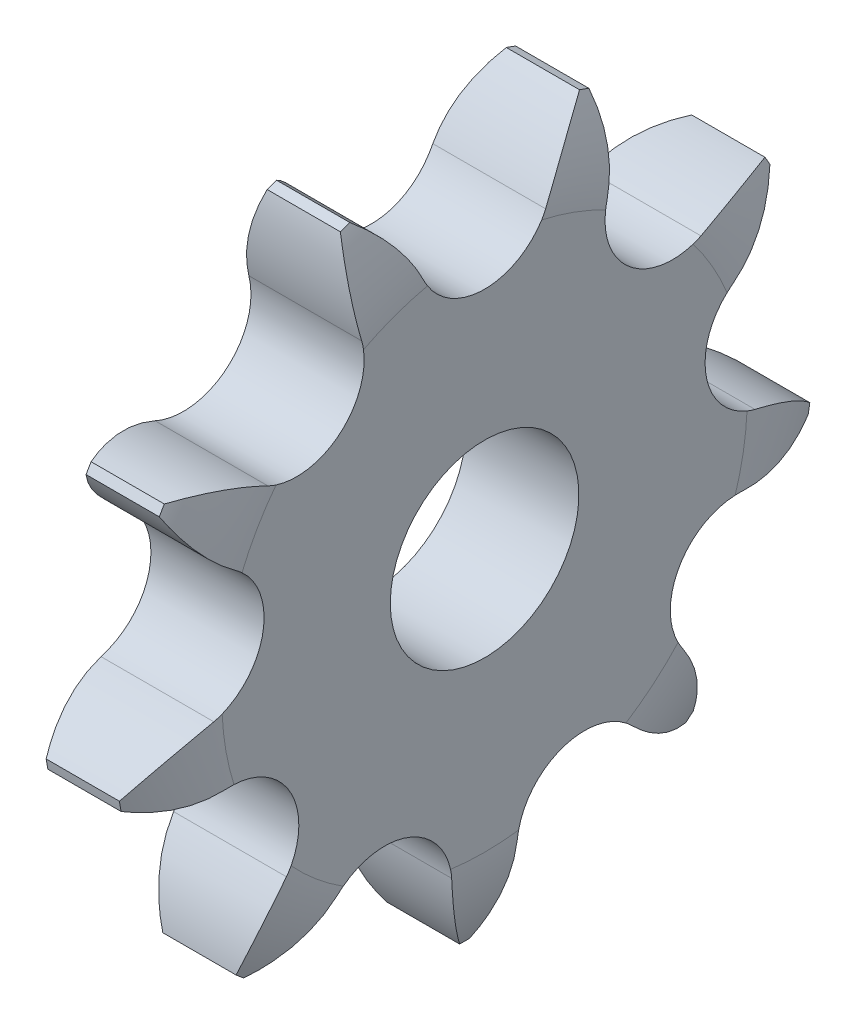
SolidWorks part; units mm, degrees
ref_plane "Plane1" through (0, 0, 0) normal (0, 0, 1) x (1, 0, 0)
ref_plane "Plane2" through (0, 0, 0) normal (0, 1, 0) x (1, 0, 0)
ref_plane "Plane3" through (0, 0, 0) normal (1, 0, 0) x (0, 0, -1)
sketch "Clipboard" plane through (0, 0, 0) normal (0, 1, 0) x (1, 0, 0)
  line L0 (0, 0) -> (12.5436, -1.9867)
  line L1 (-15, 0) -> (100, 0) construction
  line L2 (0, 0) -> (-0.8416, 0.9512)
  line L3 (0, 0) -> (-11.863, 4.5341)
  line L4 (0, 0) -> (3.0618, 0.4849)
  line L5 (0, 0) -> (-2.8109, -1.0484)
  line L6 (0, 0) -> (-5.9685, -4.027)
  line L7 (-0.8416, 0.9512) -> (8.4161, 2.5835)
  line L8 (-76.2, 38.1) -> (-75.2, 38.1)
  line L9 (-73.4259, 41.6592) -> (-72.8306, 41.7344)
  line L10 (-73.4741, 12.7512) -> (-59.5541, 12.7512)
  circle A0 centre (0, 0) radius 4.255
  circle A1 centre (0, 0) radius 10.1515
  circle A2 centre (0, 0) radius 25
sketch "BasProSke" plane through (0, 0, 0) normal (0, 1, 0) x (1, 0, 0)
  line L0 (-10, 0) -> (60, 0) construction
  line L1 (0, 0) -> (0, 16.7129)
  line L2 (0, 0) -> (7.2, 0)
  line L3 (7.2, 0) -> (7.2, 16.7129)
  line L4 (5.93, 22.2487) -> (1.27, 22.2487)
  arc A0 (0, 16.7129) -> (1.27, 22.2487) centre (12.7, 16.7129) cw
  arc A1 (7.2, 16.7129) -> (5.93, 22.2487) centre (-5.5, 16.7129) ccw
revolve "Base-Revolve" add sketch "BasProSke" angle 360 about L0
sketch "TooCutSke" plane through (0, 0, 0) normal (1, 0, 0) x (0, 0, -1)
  line L0 (0, 18.6087) -> (3.8949, 16.7925) construction
  line L1 (0, 0) -> (0, 107) construction
  line L2 (0, 18.6087) -> (-10, 18.6087) construction
  line L3 (0, 18.6087) -> (-3.8949, 16.7925) construction
  arc A0 (3.8949, 16.7925) -> (7.8075, 21.3669) centre (14.0756, 12.0451) cw
  arc A1 (3.8949, 16.7925) -> (-3.8949, 16.7925) centre (0, 18.6087) cw
  arc A2 (-3.8949, 16.7925) -> (-7.8075, 21.3669) centre (-14.0756, 12.0451) ccw
  arc A3 (7.8075, 21.3669) -> (-7.8075, 21.3669) centre (0, 0) ccw
extrude "ToothCut" cut sketch "TooCutSke" along normal through all
pattern_circular "TeethCuts" count 9 every 40 about axis through (-10, 0, 0) along (1, 0, 0) of "ToothCut"
sketch "HubNeaOneSke" plane through (0, 0, 0) normal (-1, 0, 0) x (0, 0, 1)
  circle A0 centre (0, 0) radius 10.1515
extrude "HubNearOne" [suppressed] add sketch "HubNeaOneSke" along normal blind 2.2005
fillet "HubNearOneFillet" [suppressed] radius 0.6
sketch "HubNeaBotSke" plane through (0, 0, 0) normal (-1, 0, 0) x (0, 0, 1)
  circle A0 centre (0, 0) radius 10.1515
extrude "HubNearBoth" [suppressed] add sketch "HubNeaBotSke" along normal blind 1.1003
fillet "HubNearBothFillet" [suppressed] radius 0.6
ref_plane "FarPln" through (7.2, 0, 0) normal (1, 0, 0) x (0, 0, -1)
sketch "HubFarSke" plane through (7.2, 0, 0) normal (1, 0, 0) x (0, 0, -1)
  circle A0 centre (0, 0) radius 10.1515
extrude "HubFar" [suppressed] add sketch "HubFarSke" along normal blind 1.1003
fillet "HubFarFillet" [suppressed] radius 0.6
sketch "BorSke" plane through (0, 0, 0) normal (1, 0, 0) x (0, 0, -1)
  circle A0 centre (0, 0) radius 6
extrude "Bore" cut sketch "BorSke" along normal mid plane 18.801
sketch "KeySke" plane through (0, 0, 0) normal (1, 0, 0) x (0, 0, -1)
  line L0 (-1, 0) -> (-1, 7)
  line L1 (-1, 7) -> (1, 7)
  line L2 (1, 7) -> (1, 0)
  line L3 (0, 0) -> (0, 34) construction
  line L4 (-1, 0) -> (1, 0)
extrude "Keyway" [suppressed] cut sketch "KeySke" along normal mid plane 18.801
pattern_circular "Keyway2" [suppressed] count 2 every 90 about axis through (-10, 0, 0) along (1, 0, 0)
equation "' \"Pitch@Clipboard\" = 12.7"
equation "' \"Num_strands@Clipboard\" = 1"
equation "' \"Num_teeth@Clipboard\" = 9"
equation "' \"Hub_dia@Clipboard\" = 50"
equation "' \"Overall_len@Clipboard\" = 3"
equation "' \"Diameter@BorSke\" = 12"
equation "' \"T_dim@Clipboard\" = 1"
equation "' \"Width@KeySke\" = 2"
equation "' \"Dr@Clipboard\" = 8.51"
equation "' \"Face_width@Clipboard\" = 7.2"
equation "' \"Side_radius@Clipboard\" = 12.7"
equation "' \"Side_relief@Clipboard\" = 1.27"
equation "' \"Transv_pitch@Clipboard\" = 13.92"
equation "' \"Show_teeth@Clipboard\" = 9"
equation "' \"Fillet_rad@Clipboard\" = 0.6"
equation "' \"Plate_wid@Clipboard\" = 11.8"
equation "\"Num_teeth@Clipboard\" = int( \"Num_teeth@Clipboard\" )"
equation "\"Num_teeth@Clipboard\" = ((sgn( \"Num_teeth@Clipboard\" - 5.0)+1)*( \"Num_teeth@Clipboard\" - 5.0))/2 +5.0"
equation "\"Num_teeth@Clipboard\" = ((sgn( \"Num_teeth@Clipboard\" - 200.0)-1)*( \"Num_teeth@Clipboard\" - 200.0))/-2 +200.0"
equation "\"MHD@Clipboard\" = \"Pitch@Clipboard\" * (1.0 / tan(3.14159265 / \"Num_teeth@Clipboard\" )) - 1.05 * \"Plate_wid@Clipboard\" - 2.0 * \"Fillet_rad@Clipboard\" - 1.0"
equation "\"Thickness@Clipboard\"  = \"Face_width@Clipboard\" + (\"Num_strands@Clipboard\" - 1) * \"Transv_pitch@Clipboard\""
equation "\"OAL@Clipboard\" = \"Thickness@Clipboard\" + 2 * \"Fillet_rad@Clipboard\" + 1"
equation "\"MHD@Clipboard\" = ((sgn( \"MHD@Clipboard\" - \"Hub_dia@Clipboard\" )-1)*( \"MHD@Clipboard\" - \"Hub_dia@Clipboard\" ))/-2+ \"Hub_dia@Clipboard\""
equation "\"OAL@Clipboard\" = ((sgn( \"OAL@Clipboard\" - \"Overall_len@Clipboard\" )+1)*( \"OAL@Clipboard\" - \"Overall_len@Clipboard\" ))/2 + \"Overall_len@Clipboard\" + 0.0005"
equation "\"Num_teeth@TeethCuts\" = int( \"Show_teeth@Clipboard\" ) + 1"
equation "\"Num_teeth@TeethCuts\" = ((sgn( \"Num_teeth@TeethCuts\" - \"Num_teeth@Clipboard\" )-1)*( \"Num_teeth@TeethCuts\" - \"Num_teeth@Clipboard\" ))/-2+ \"Num_teeth@Clipboard\""
equation "\"Num_teeth@TeethCuts\" = ((sgn( \"Num_teeth@TeethCuts\" - 2.0)+1)*( \"Num_teeth@TeethCuts\" - 2.0))/2 +2.0"
equation "\"Angle@TeethCuts\" = 360.0 / \"Num_teeth@Clipboard\""
equation "\"Seat_radius@TooCutSke\" = ( \"Pitch@Clipboard\" / 2.0) / sin(3.14159265 / \"Num_teeth@Clipboard\" ) - \"Dr@Clipboard\" / 2.0 + \"Dr@Clipboard\" * 0.505"
equation "\"R1@TooCutSke\"  = \"Dr@Clipboard\" * 0.505"
equation "\"X@TooCutSke\" = 140.0 - (90.0 / \"Num_teeth@Clipboard\")"
equation "\"R2@TooCutSke\" = 0.12 * \"Dr@Clipboard\" * ( \"Num_teeth@Clipboard\" + 2.0)"
equation "\"Overcut@TooCutSke\" = 0.5 + 0.625 * \"Pitch@Clipboard\" - 0.5 * \"Dr@Clipboard\"  +  \"Pitch@Clipboard\" / 2.0 / sin(3.14159265 / \"Num_teeth@Clipboard\" )"
equation "\"Diameter@BasProSke\" = 2.0 * ( 0.625 * \"Pitch@Clipboard\" - 0.5 * \"Dr@Clipboard\"  +  \"Pitch@Clipboard\" / 2.0 / sin(3.14159265 / \"Num_teeth@Clipboard\" ))"
equation "\"Thickness@BasProSke\"  = \"Thickness@Clipboard\""
equation "\"G1@BasProSke\" =  \"Side_relief@Clipboard\""
equation "\"G2@BasProSke\" =  \"Side_relief@Clipboard\""
equation "\"D1@BasProSke\" =  \"Side_radius@Clipboard\""
equation "\"Diameter@HubNeaOneSke\" = \"MHD@Clipboard\""
equation "\"Length@HubNearOne\" = \"OAL@Clipboard\" - \"Thickness@BasProSke\""
equation "\"Diameter@HubNeaBotSke\" = \"MHD@Clipboard\""
equation "\"Length@HubNearBoth\" = ( \"OAL@Clipboard\" - \"Thickness@BasProSke\" ) / 2.0"
equation "\"D1@HubNearOneFillet\" = \"Fillet_rad@Clipboard\""
equation "\"D1@HubNearBothFillet\" = \"Fillet_rad@Clipboard\""
equation "\"Thickness@FarPln\" = \"Thickness@BasProSke\""
equation "\"Diameter@HubFarSke\" = \"MHD@Clipboard\""
equation "\"Length@HubFar\" = ( \"OAL@Clipboard\" - \"Thickness@BasProSke\" ) / 2.0"
equation "\"D1@HubFarFillet\" = \"Fillet_rad@Clipboard\""
equation "\"D1@Bore\" = \"OAL@Clipboard\" * 2.0"
equation "\"D1@Keyway\" = \"OAL@Clipboard\" * 2.0"
equation "\"Offset@KeySke\" = \"T_dim@Clipboard\" + \"Diameter@BorSke\" / 2.0"
